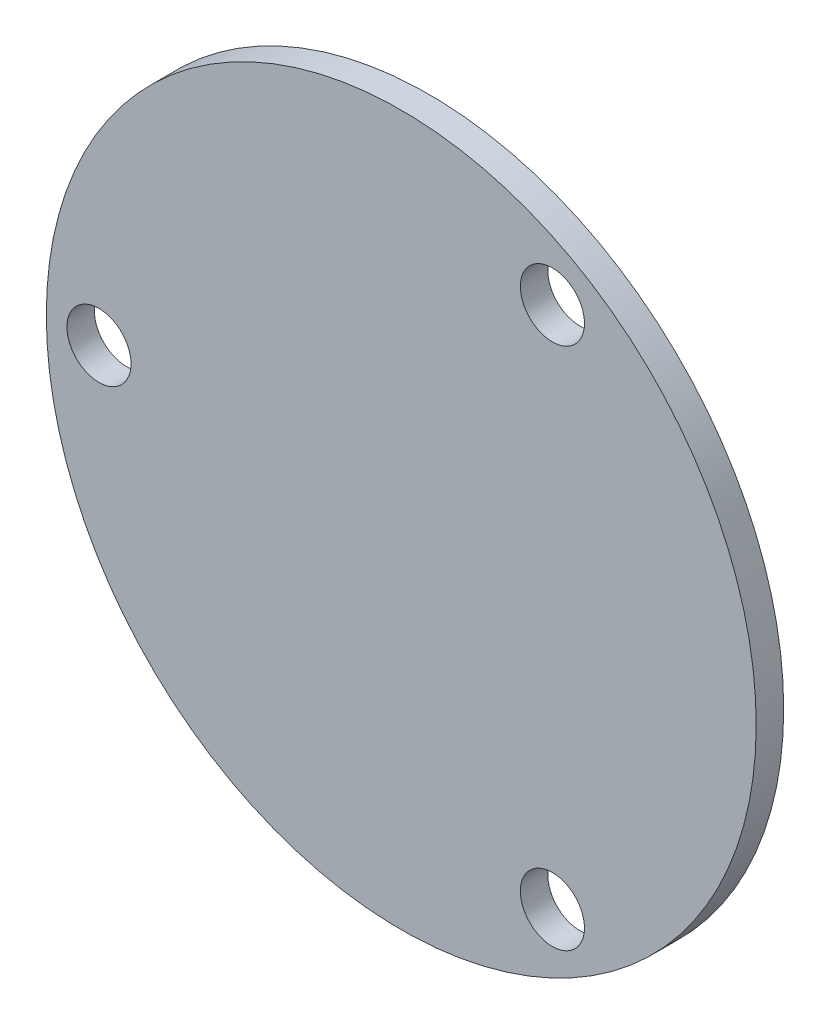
SolidWorks part; units mm, degrees
ref_plane "Plan de face" through (0, 0, 0) normal (0, 0, 1) x (1, 0, 0)
ref_plane "Plan de dessus" through (0, 0, 0) normal (0, 1, 0) x (1, 0, 0)
ref_plane "Plan de droite" through (0, 0, 0) normal (1, 0, 0) x (0, 0, -1)
sketch "Esquisse1" plane through (0, 0, 0) normal (0, 0, 1) x (1, 0, 0)
  line L0 (0, 0) -> (16.5, 28.5788) construction
  line L1 (0, 0) -> (16.5, -28.5788) construction
  line L2 (0, 0) -> (-33, 0) construction
  circle A1 centre (0, 0) radius 33 construction
  circle A2 centre (0, 0) radius 38.75
  circle A3 centre (-33, 0) radius 3.5
  circle A6 centre (16.5, 28.5788) radius 3.5
  circle A7 centre (16.5, -28.5788) radius 3.5
  dimension "D1" = 77.5
  dimension "D2" = 66
  dimension "D3" = 7
  dimension "D4" = 7
  dimension "D5" = 7
  dimension "D6" = 120
  dimension "D7" = 120
extrude "Boss.-Extru.1" add sketch "Esquisse1" along normal blind 3
